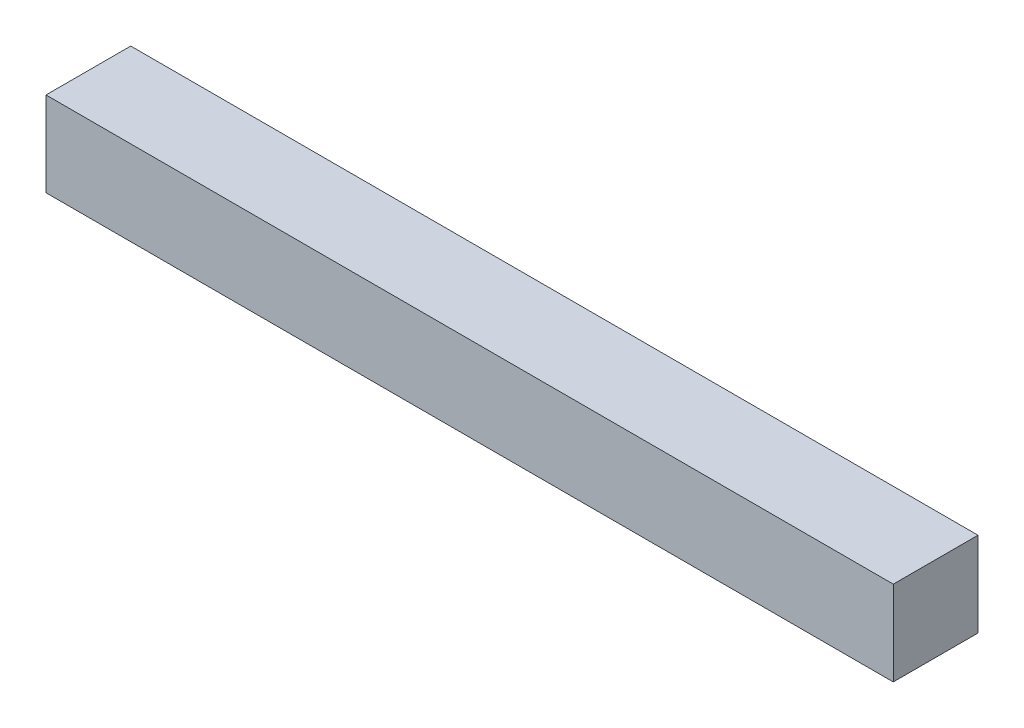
SolidWorks part; units mm, degrees
ref_plane "Front Plane" through (0, 0, 0) normal (0, 0, 1) x (1, 0, 0)
ref_plane "Top Plane" through (0, 0, 0) normal (0, 1, 0) x (1, 0, 0)
ref_plane "Right Plane" through (0, 0, 0) normal (1, 0, 0) x (0, 0, -1)
sketch "Sketch1" plane through (0, 0, 0) normal (0, 1, 0) x (1, 0, 0)
  line L1 (0, 0) -> (100, 0)
  line L2 (0, 0) -> (0, 10)
  line L3 (0, 10) -> (100, 10)
  line L4 (100, 0) -> (100, 10)
  dimension "D1" = 100
  dimension "D2" = 10
extrude "Boss-Extrude1" add sketch "Sketch1" along normal blind 10
